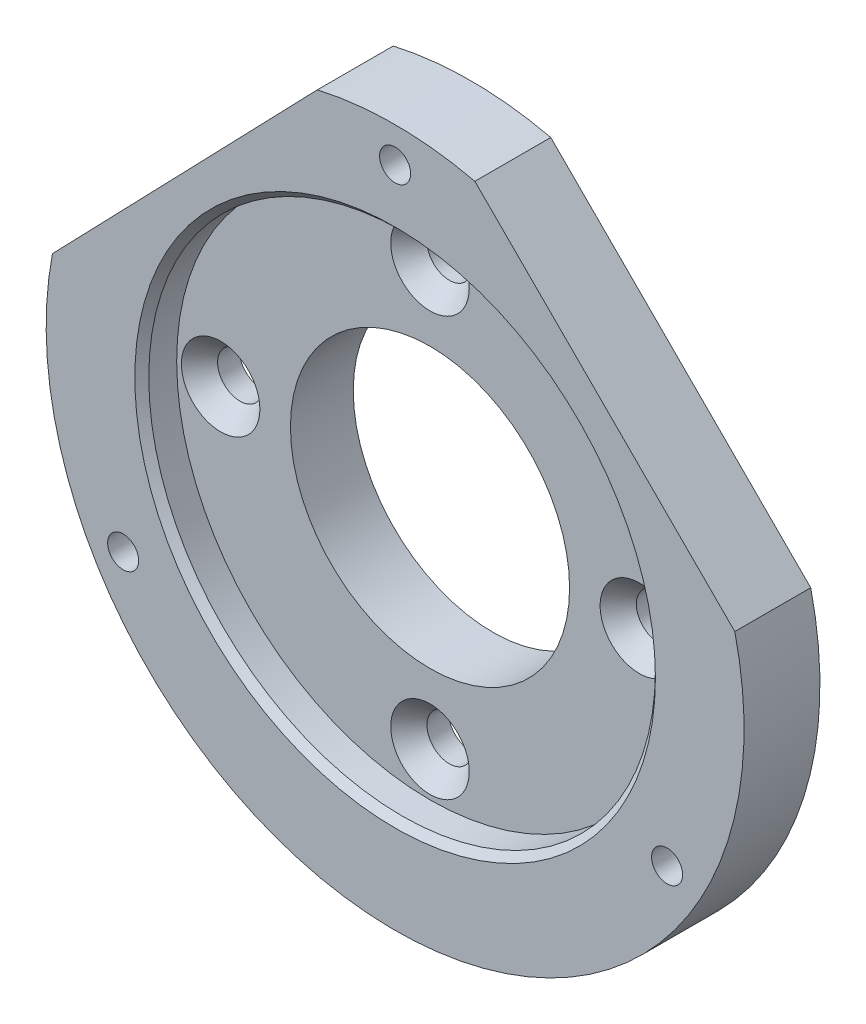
SolidWorks part; units mm, degrees
ref_plane "Front Plane" through (0, 0, 0) normal (0, 0, 1) x (1, 0, 0)
ref_plane "Top Plane" through (0, 0, 0) normal (0, 1, 0) x (1, 0, 0)
ref_plane "Right Plane" through (0, 0, 0) normal (1, 0, 0) x (0, 0, -1)
sketch "Sketch1" plane through (0, 0, 0) normal (0, 0, 1) x (1, 0, 0)
  circle A0 centre (0, 0) radius 25.4
  dimension "D1" = 50.8
extrude "disk_2od" add sketch "Sketch1" along normal blind 7.112
sketch "Sketch3" plane through (0, 0, 0) normal (0, 0, -1) x (-1, 0, 0)
  circle A0 centre (0, 0) radius 10.16
  dimension "D1" = 20.32
extrude "thru_hole" cut sketch "Sketch3" against normal through all
sketch "Sketch7" plane through (0, 0, 7.112) normal (0, 0, 1) x (1, 0, 0)
  circle A0 centre (0, 0) radius 18.4404
  dimension "D1" = 36.8808
extrude "cbore_for_motor_flange" cut sketch "Sketch7" against normal blind 2.54
sketch "Sketch6" plane through (0, 0, 7.112) normal (0, 0, 1) x (1, 0, 0)
  circle A1 centre (19.7973, -11.43) radius 1.1303
  circle A2 centre (-19.7973, -11.43) radius 1.1303
  circle A3 centre (0, 0) radius 22.86 construction
  circle A4 centre (0, 22.86) radius 1.1303
  dimension "D3" = 45.72
  dimension "D2" = 2.2606
  dimension "D1" = 22.86
extrude "motor_bcd_4-40tapped" cut sketch "Sketch6" against normal through all
sketch "Sketch2" plane through (0, 0, 0) normal (0, 0, -1) x (-1, 0, 0)
  circle A0 centre (0, 0) radius 12.6746
  dimension "D1" = 25.3492
extrude "lip" cut sketch "Sketch2" against normal blind 1.5875 flip side to cut
sketch "Sketch9" plane through (0, 0, 4.572) normal (0, 0, 1) x (1, 0, 0)
  line L0 (0, 0) -> (15.24, 0) construction
  circle A0 centre (15.24, 0) radius 1.4732
  circle A1 centre (0, -15.24) radius 1.4732
  circle A2 centre (-15.24, 0) radius 1.4732
  circle A3 centre (0, 15.24) radius 1.4732
  dimension "D1" = 15.24
hole_wizard "CSK for #4 Flat Head Machine Screw1" positions "3DSketch2" profile "Sketch10" countersink size "#4" standard "Ansi Inch"
sketch3d "3DSketch2"
  point P0 (15.24, 0, 4.572)
  point P2 (0, 15.24, 4.572)
  point P4 (-15.24, 0, 4.572)
  point P6 (0, -15.24, 4.572)
  point P8 (-15.24, 0, 4.572)
  point P10 (0, 15.24, 4.572)
sketch "Sketch10" plane through (15.24, 0, 4.572) normal (1, 0, 0) x (0, -1, 0)
  line L0 (0, 0) -> (0, 4.572)
  line L1 (0, 4.572) -> (1.6319, 4.572)
  line L2 (1.6319, 4.572) -> (1.6319, 1.4098)
  line L3 (1.6319, 1.4098) -> (2.8575, 0)
  line L5 (2.8575, 0) -> (0, 0)
  line L6 (-1.632, 1.4098) -> (-2.8575, 0) construction
  line L11 (0, -6.35) -> (0, 107.95) construction
  dimension "Thru Hole Dia." = 3.2639
  dimension "Thru Hole Depth" = 4.572
  dimension "Near C'Sink Dia." = 5.715
  dimension "Near C'Sink Angle" = 82
sketch "Sketch11" plane through (0, 0, 7.112) normal (0, 0, 1) x (1, 0, 0)
  line L0 (0, 0) -> (15.2664, 15.2664) construction
  line L1 (0, 0) -> (25.4, 0) construction
  line L2 (0.898, 29.6348) -> (29.6348, 0.898)
  line L3 (0.898, 29.6348) -> (5.3882, 34.125)
  line L4 (5.3882, 34.125) -> (34.125, 5.3882)
  line L5 (34.125, 5.3882) -> (29.6348, 0.898)
  line L6 (0.2208, 0.2208) -> (0, 25.4) construction
  line L7 (-33.7689, 4.7929) -> (-29.2007, 0.3822)
  line L8 (-0.9721, 29.6184) -> (-29.2007, 0.3822)
  line L9 (-0.9721, 29.6184) -> (-5.5403, 34.0292)
  line L10 (-5.5403, 34.0292) -> (-33.7689, 4.7929)
  circle A0 centre (0, 0) radius 25.4 construction
  dimension "D1" = 45
  dimension "D2" = 6.35
  dimension "D3" = 21.59
  dimension "D4" = 40.64
extrude "45_deg_cut" cut sketch "Sketch11" against normal through all
chamfer "Chamfer1" distance 0.508 angle 45 1 edges at (18.4404, 0, 7.112)
chamfer "Chamfer2" distance 0.254 angle 45 1 edges at (-12.6746, 0, 0)
